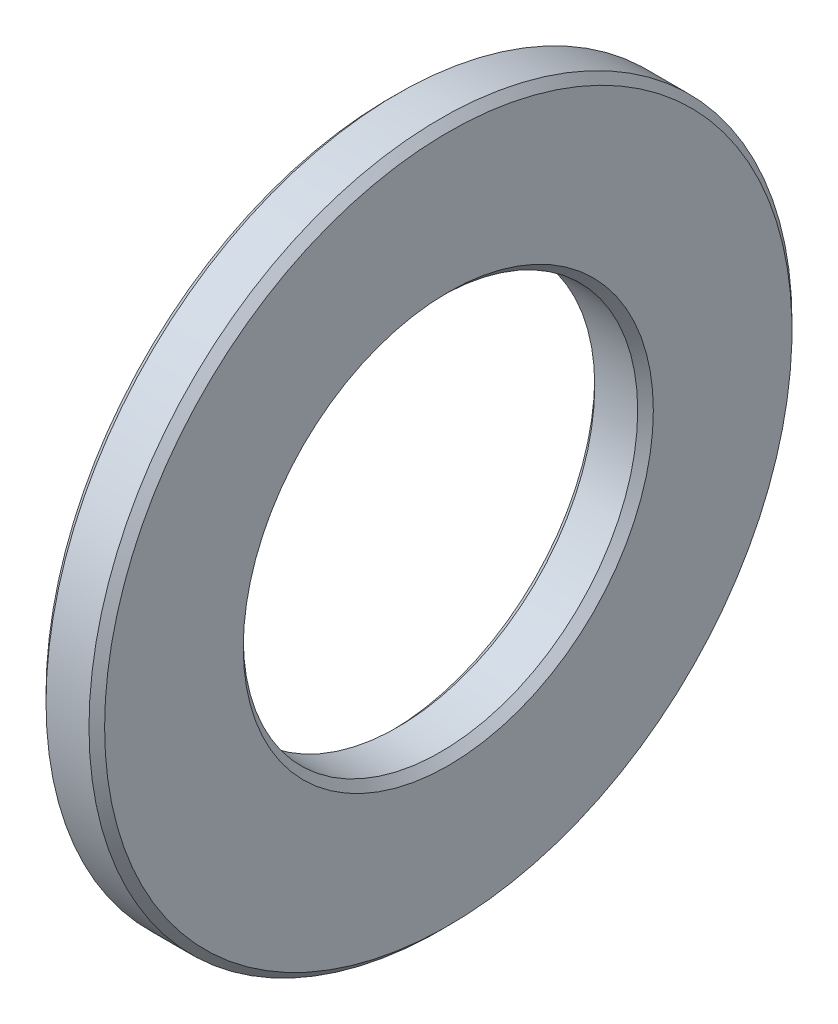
SolidWorks part; units mm, degrees
ref_plane "Plan de face" through (0, 0, 0) normal (0, 0, 1) x (1, 0, 0)
ref_plane "Plan de dessus" through (0, 0, 0) normal (0, 1, 0) x (1, 0, 0)
ref_plane "Plan de droite" through (0, 0, 0) normal (1, 0, 0) x (0, 0, -1)
sketch "Esquisse1" plane through (0, 0, 0) normal (0, 0, 1) x (1, 0, 0)
  line L0 (0, 0) -> (20.883, 0) construction
  line L1 (0, 8.8) -> (0.2, 9)
  line L2 (0.2, 5.05) -> (1.3, 5.05)
  line L3 (0, 5.25) -> (0, 8.8)
  line L4 (0.2, 9) -> (1.3, 9)
  line L5 (1.5, 5.25) -> (1.5, 8.8)
  line L6 (1.3, 9) -> (1.5, 8.8)
  line L7 (1.3, 5.05) -> (1.5, 5.25)
  line L8 (0, 5.25) -> (0.2, 5.05)
  point P3 (0, 5.05)
  point P4 (1.5, 9)
  point P5 (0, 9)
  point P6 (1.5, 5.05)
  dimension "D1" = 10.1
  dimension "D2" = 18
  dimension "D3" = 1.5
revolve "Révolution1" add sketch "Esquisse1" angle 360 about L0
